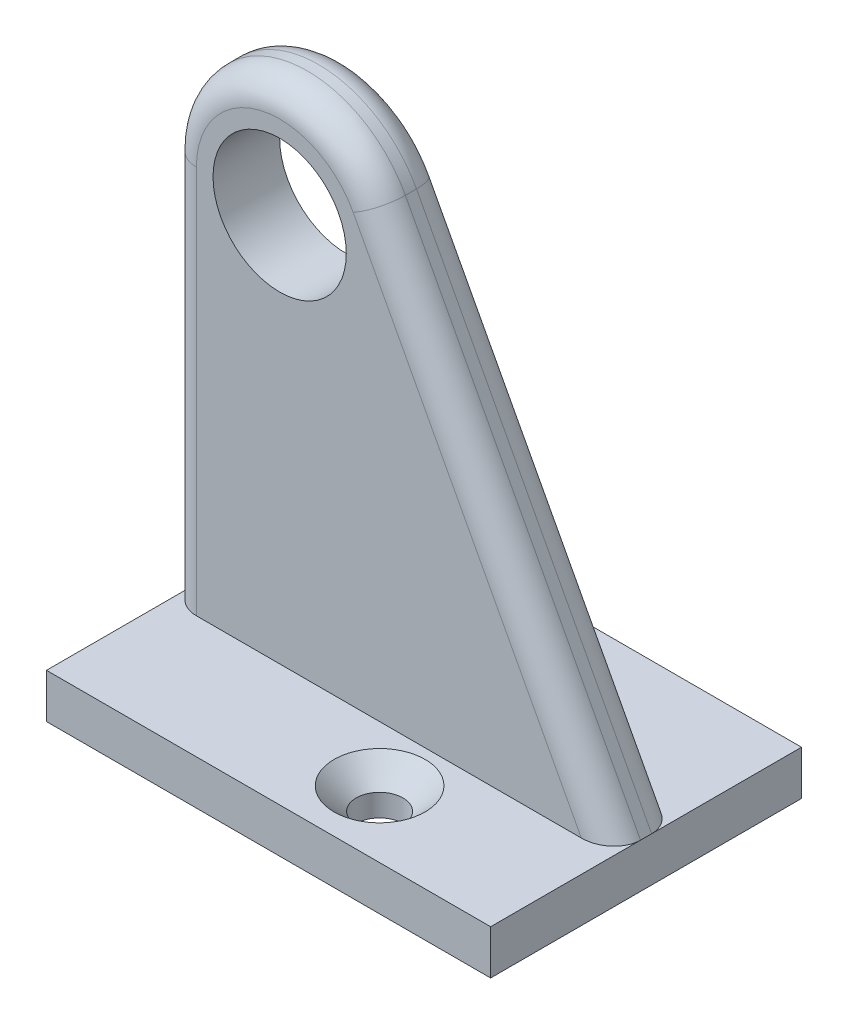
SolidWorks part; units mm, degrees
ref_plane "Plan de face" through (0, 0, 0) normal (0, 0, 1) x (1, 0, 0)
ref_plane "Plan de dessus" through (0, 0, 0) normal (0, 1, 0) x (1, 0, 0)
ref_plane "Plan de droite" through (0, 0, 0) normal (1, 0, 0) x (0, 0, -1)
ref_plane "Plan1" through (0, 0, 3) normal (0, 0, 1) x (1, 0, 0)
sketch "Esquisse1" plane through (0, 0, 3) normal (0, 0, 1) x (1, 0, 0)
  line L0 (-20, 35) -> (-20, -4)
  line L1 (-20, -4) -> (20, -4)
  line L2 (20, -4) -> (20, 0)
  line L3 (20, 0) -> (-1.1765, 39.7059)
  arc A0 (-1.1765, 39.7059) -> (-20, 35) centre (-10, 35) ccw
extrude "Boss.-Extru.1" add sketch "Esquisse1" against normal blind 6
sketch "Esquisse2" plane through (0, 0, 3) normal (0, 0, 1) x (1, 0, 0)
  line L0 (20, -4) -> (-20, -4)
  line L1 (-20, -4) -> (-20, 0)
  line L2 (-20, 0) -> (20, 0)
  line L3 (20, 0) -> (20, -4)
extrude "Boss.-Extru.2" add sketch "Esquisse2" along normal blind 11
sketch "Esquisse3" plane through (0, 0, -3) normal (0, 0, -1) x (-1, 0, 0)
  line L0 (20, -4) -> (-20, -4)
  line L1 (-20, -4) -> (-20, 0)
  line L2 (-20, 0) -> (20, 0)
  line L3 (20, 0) -> (20, -4)
extrude "Boss.-Extru.3" add sketch "Esquisse3" along normal blind 11
hole_wizard "Fraisage pour vis à tête fraisée M3.52" positions "Esquisse5" profile "Esquisse4" countersink size "M3.5" standard "Ansi Metric"
sketch "Esquisse5" plane through (0, 0, 0) normal (0, 1, 0) x (1, 0, 0)
  point P0 (-14, 8)
  point P1 (4, -8)
sketch "Esquisse4" plane through (-14, 0, -8) normal (1, 0, 0) x (0, 0, 1)
  line L0 (0, 0) -> (0, 4)
  line L1 (0, 4) -> (2.1, 4)
  line L2 (2.1, 4) -> (2.1, 2)
  line L3 (2.1, 2) -> (4.1, 0)
  line L5 (4.1, 0) -> (0, 0)
  line L6 (-2.1, 2) -> (-4.1, 0) construction
  line L11 (0, -6.35) -> (0, 107.95) construction
  dimension "Diamètre du perçage jusqu'au prochain" = 4.2
  dimension "Profondeur du perçage jusqu'au prochain" = 4
  dimension "Diamètre du fraisage entrant" = 8.2
  dimension "Angle du fraisage entrant" = 90
hole_wizard "Diamètre du perçage Ø12.0 (12)1" positions "Esquisse7" profile "Esquisse6" hole size "Ø12.0" standard "Ansi Metric"
sketch "Esquisse7" plane through (0, 0, -3) normal (0, 0, -1) x (-1, 0, 0)
  point P0 (10, 35)
sketch "Esquisse6" plane through (-10, 35, -3) normal (1, 0, 0) x (0, 1, 0)
  line L0 (0, 0) -> (0, 17)
  line L1 (0, 17) -> (6, 17)
  line L2 (6, 17) -> (6, 0)
  line L5 (6, 0) -> (0, 0)
  line L11 (0, -6.35) -> (0, 107.95) construction
  dimension "Diamètre du perçage jusqu'au prochain" = 12
  dimension "Profondeur du perçage jusqu'au prochain" = 17
fillet "Congé1" radius 2.5 6 edges at (-20, 17.5, -3) (-12.4254, 44.7014, -3) (9.4118, 19.8529, -3) (9.4118, 19.8529, 3) (-12.4254, 44.7014, 3) (-20, 17.5, 3)
